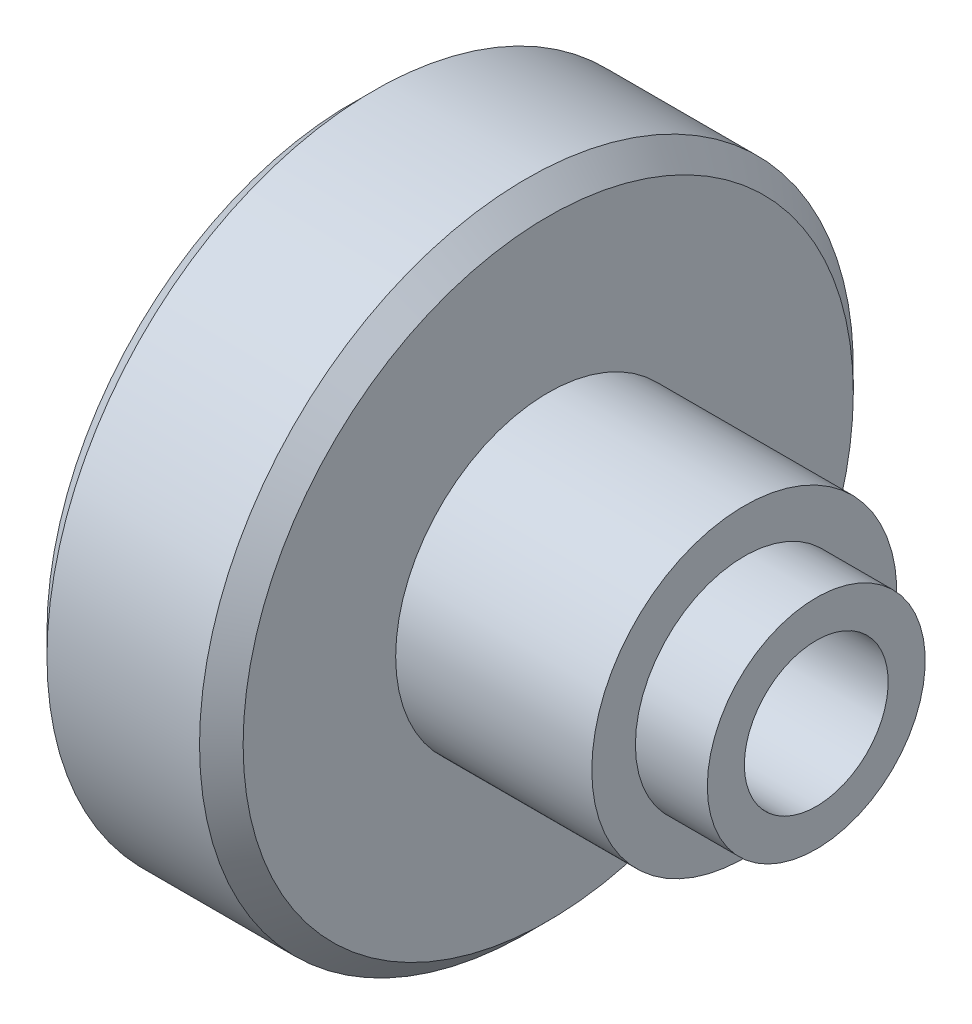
SolidWorks part; units mm, degrees
ref_plane "Front Plane" through (0, 0, 0) normal (0, 0, 1) x (1, 0, 0)
ref_plane "Top Plane" through (0, 0, 0) normal (0, 1, 0) x (1, 0, 0)
ref_plane "Right Plane" through (0, 0, 0) normal (1, 0, 0) x (0, 0, -1)
sketch "Sketch1" plane through (0, 0, 0) normal (0, 0, 1) x (1, 0, 0)
  line L0 (0, 0) -> (21.3, 0) construction
  line L1 (0, 6.3) -> (0, 15)
  line L2 (0, 15) -> (9, 15)
  line L3 (9, 15) -> (9, 7)
  line L4 (9, 7) -> (18, 7)
  line L5 (18, 7) -> (18, 5)
  line L6 (18, 5) -> (21.3, 5)
  line L7 (21.3, 5) -> (21.3, 3.3)
  line L8 (0, 0) -> (21.3, 0) construction
  line L9 (21.3, 3.3) -> (3, 3.3)
  line L10 (3, 3.3) -> (0, 6.3)
  dimension "D1" = 15
  dimension "D2" = 5
  dimension "D3" = 7
  dimension "D4" = 9
  dimension "D5" = 9
  dimension "D6" = 3.3
  dimension "D7" = 45
  dimension "D8" = 3.3
  dimension "D9" = 6.3
revolve "Revolve1" add sketch "Sketch1" angle 360 about L0
chamfer "Chamfer1" distance 1 angle 45 2 edges at (9, 0, 15) (0, 0, 15)
